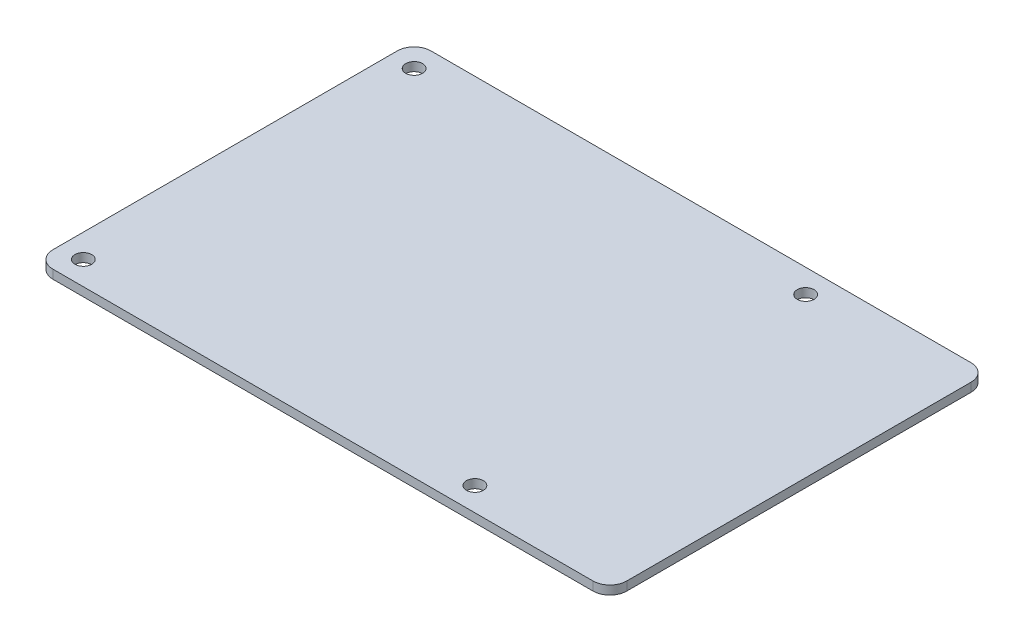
SolidWorks part; units mm, degrees
ref_plane "Piano frontale" through (0, 0, 0) normal (0, 0, 1) x (1, 0, 0)
ref_plane "Piano superiore" through (0, 0, 0) normal (0, 1, 0) x (1, 0, 0)
ref_plane "Piano destro" through (0, 0, 0) normal (1, 0, 0) x (0, 0, -1)
sketch "Schizzo1" plane through (0, 0, 0) normal (0, 1, 0) x (1, 0, 0)
  line L0 (42.5, -25.5) -> (42.5, 25.5)
  line L1 (40, 28) -> (-40, 28)
  line L2 (-42.5, 25.5) -> (-42.5, -25.5)
  line L3 (-40, -28) -> (40, -28)
  line L4 (-39, -24.5) -> (19, -24.5) construction
  line L5 (19, -24.5) -> (19, 24.5) construction
  line L6 (19, 24.5) -> (-39, 24.5) construction
  line L7 (-39, 24.5) -> (-39, -24.5) construction
  line L8 (0, 0) -> (19, 0) construction
  line L9 (-41.7678, -27.2678) -> (0, 0) construction
  line L10 (41.7678, -27.2678) -> (0, 0) construction
  line L11 (0, 0) -> (-41.7678, 27.2678) construction
  line L12 (0, 0) -> (41.7678, 27.2678) construction
  line L13 (-41.7678, -27.2678) -> (-39, -24.5) construction
  line L14 (-41.7678, 27.2678) -> (-39, 24.5) construction
  arc A0 (42.5, 25.5) -> (40, 28) centre (40, 25.5) ccw
  arc A1 (-40, 28) -> (-42.5, 25.5) centre (-40, 25.5) ccw
  arc A2 (-42.5, -25.5) -> (-40, -28) centre (-40, -25.5) ccw
  arc A3 (40, -28) -> (42.5, -25.5) centre (40, -25.5) ccw
  circle A4 centre (19, 24.5) radius 1.25
  circle A5 centre (-39, 24.5) radius 1.25
  circle A6 centre (-39, -24.5) radius 1.25
  circle A7 centre (19, -24.5) radius 1.25
  dimension "D3" = 2.5
  dimension "D4" = 2.5
  dimension "D7" = 2.25
  dimension "D10" = 49
  dimension "D1" = 56
  dimension "D2" = 85
  dimension "D5" = 45
  dimension "D6" = 58
  dimension "D8" = 45
extrude "Estrusione-Estrusione1" add sketch "Schizzo1" against normal blind 1.3
ref_plane "Plane1" through (0, -3.1465, 0) normal (0, 1, 0) x (1, 0, 0)
